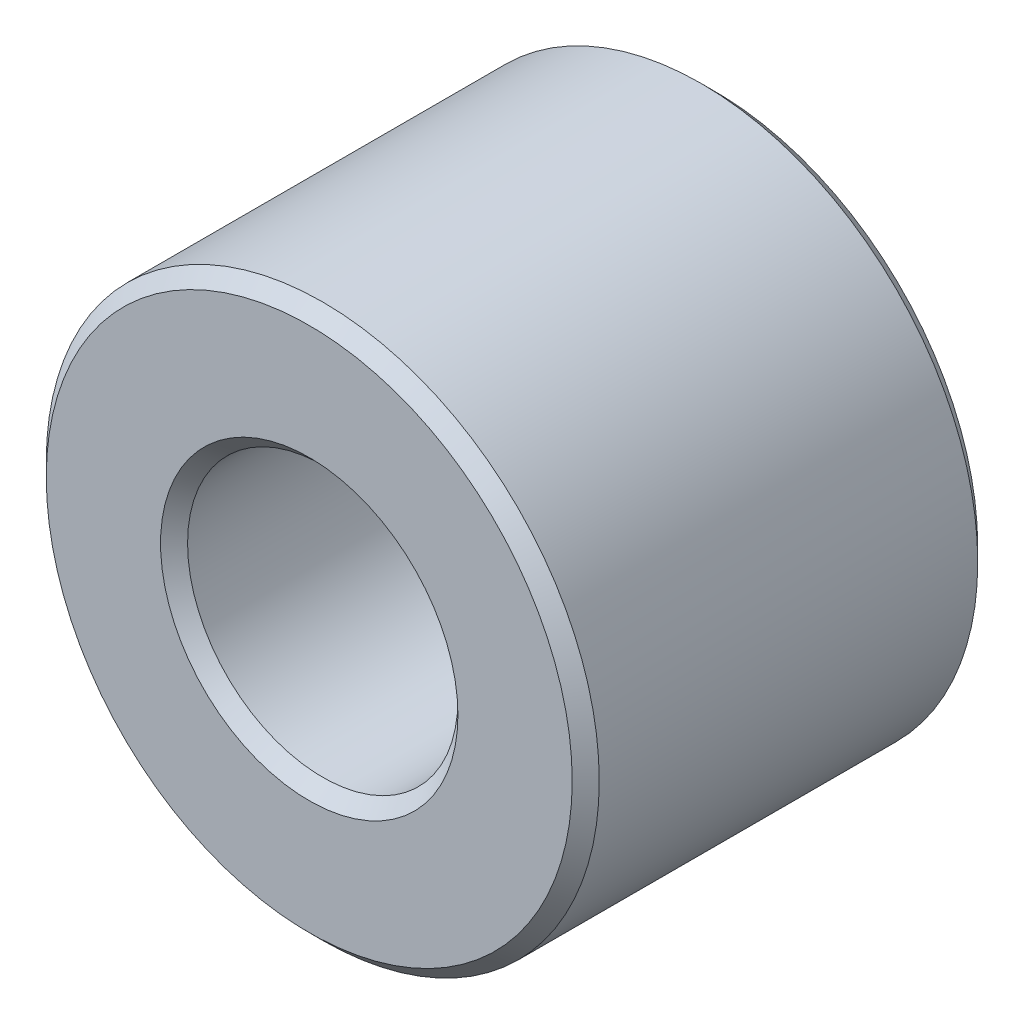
SolidWorks part; units mm, degrees
ref_plane "Front Plane" through (0, 0, 0) normal (0, 0, 1) x (1, 0, 0)
ref_plane "Top Plane" through (0, 0, 0) normal (0, 1, 0) x (1, 0, 0)
ref_plane "Right Plane" through (0, 0, 0) normal (1, 0, 0) x (0, 0, -1)
sketch "Sketch1" plane through (0, 0, 0) normal (0, 0, 1) x (1, 0, 0)
  circle A0 centre (0, 0) radius 11
  circle A1 centre (0, 0) radius 22.5
  dimension "D1" = 22
  dimension "D2" = 45
extrude "Boss-Extrude1" add sketch "Sketch1" along normal mid plane 33
chamfer "Chamfer1" distance 1.1 angle 45 4 edges at (11, 0, -16.5) (22.5, 0, -16.5) (11, 0, 16.5) (22.5, 0, 16.5)
